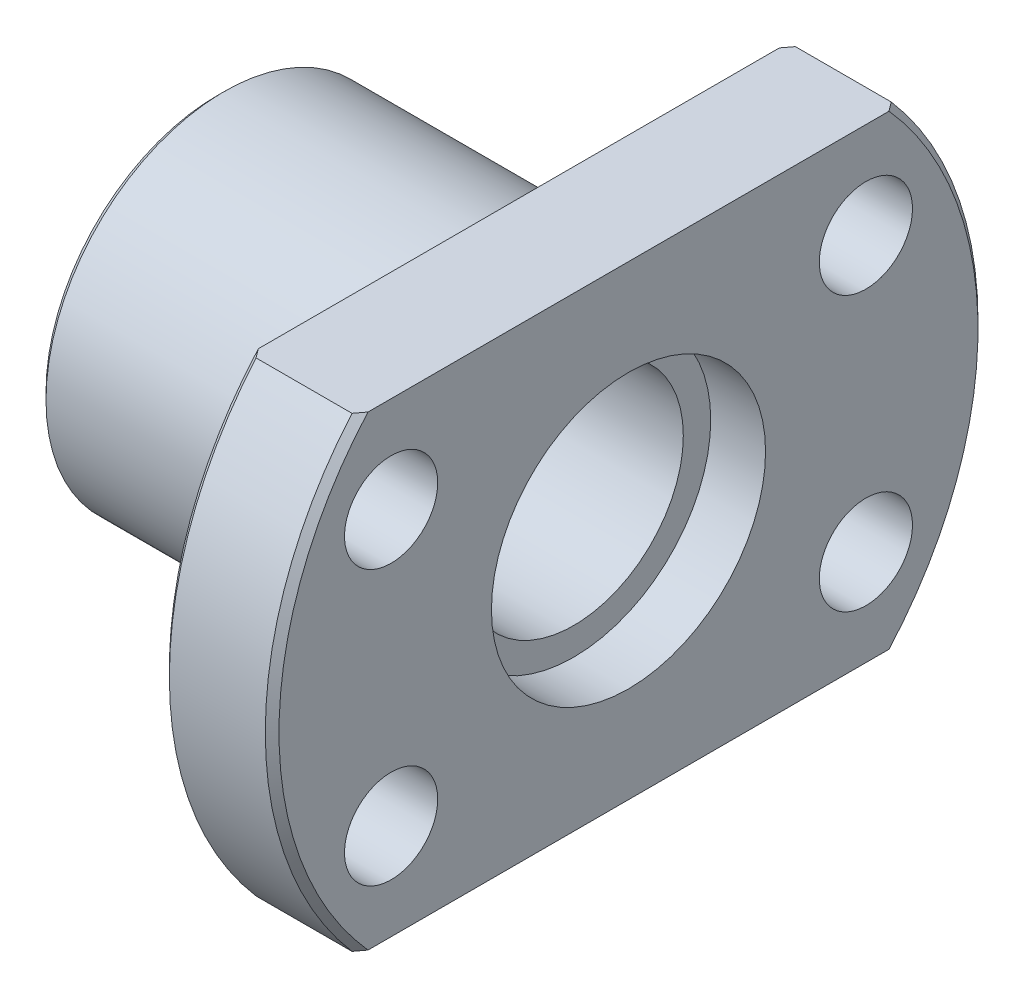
SolidWorks part; units mm, degrees
ref_plane "Front Plane" through (0, 0, 0) normal (0, 0, 1) x (1, 0, 0)
ref_plane "Top Plane" through (0, 0, 0) normal (0, 1, 0) x (1, 0, 0)
ref_plane "Right Plane" through (0, 0, 0) normal (1, 0, 0) x (0, 0, -1)
ref_plane "Plane1" through (0, 0, 0) normal (0, 0, 1) x (1, 0, 0)
sketch "Sketch1" plane through (0, 0, 0) normal (0, 0, 1) x (1, 0, 0)
  line L0 (0, 6.25) -> (0, 5)
  line L1 (0, 5) -> (2, 5)
  line L2 (2, 5) -> (2, 4)
  line L3 (2, 4) -> (13, 4)
  line L4 (13, 4) -> (13, 5)
  line L5 (13, 5) -> (15, 5)
  line L6 (15, 5) -> (15, 12.75)
  line L7 (15, 12.75) -> (14.75, 13)
  line L8 (14.75, 13) -> (11.25, 13)
  line L9 (11.25, 13) -> (11, 12.75)
  line L10 (11, 12.75) -> (11, 6)
  line L11 (11, 6) -> (10.5, 6)
  line L12 (10.5, 6) -> (10.5, 6.5)
  line L13 (10.5, 6.5) -> (0.25, 6.5)
  line L14 (0.25, 6.5) -> (0, 6.25)
  line L15 (15, 0) -> (0, 0) construction
revolve "Revolve1" add sketch "Sketch1" angle 360 about L15
ref_plane "Plane2" through (15, 0, 0) normal (1, 0, 0) x (0, 0, -1)
sketch "Sketch2" plane through (15, 0, 0) normal (1, 0, 0) x (0, 0, -1)
  line L0 (-26, 17) -> (-26, -17)
  line L1 (-26, -17) -> (26, -17)
  line L2 (26, -17) -> (26, 17)
  line L3 (26, 17) -> (-26, 17)
  line L4 (-13.1, 8.5) -> (-13.1, -8.5)
  line L5 (-13.1, -8.5) -> (13.1, -8.5)
  line L6 (13.1, -8.5) -> (13.1, 8.5)
  line L7 (13.1, 8.5) -> (-13.1, 8.5)
extrude "Cut-Extrude1" cut sketch "Sketch2" against normal blind 4
ref_plane "Plane3" through (0, 0, 0) normal (0, 0.866, 0.5) x (1, 0, 0)
sketch "Sketch3" plane through (0, 0, 0) normal (0, 0.866, 0.5) x (1, 0, 0)
  line L0 (11, 10) -> (11, 11.7)
  line L1 (11, 11.7) -> (15, 11.7)
  line L2 (15, 11.7) -> (15, 10)
  line L3 (15, 10) -> (11, 10)
  line L4 (15, 10) -> (11, 10) construction
revolve "Cut-Revolve1" cut sketch "Sketch3" angle 360 about L4
ref_plane "Plane4" through (0, -7.5, -4.3301) normal (0, 0.866, 0.5) x (1, 0, 0)
sketch "Sketch4" plane through (0, -7.5, -4.3301) normal (0, 0.866, 0.5) x (1, 0, 0)
  line L0 (11, 5) -> (11, 6.7)
  line L1 (11, 6.7) -> (15, 6.7)
  line L2 (15, 6.7) -> (15, 5)
  line L3 (15, 5) -> (11, 5)
  line L4 (15, 5) -> (11, 5) construction
revolve "Cut-Revolve2" cut sketch "Sketch4" angle 360 about L4
ref_plane "Plane5" through (0, 0, 0) normal (0, 0.866, 0.5) x (1, 0, 0)
sketch "Sketch5" plane through (0, 0, 0) normal (0, 0.866, 0.5) x (1, 0, 0)
  line L0 (11, -10) -> (11, -8.3)
  line L1 (11, -8.3) -> (15, -8.3)
  line L2 (15, -8.3) -> (15, -10)
  line L3 (15, -10) -> (11, -10)
  line L4 (15, -10) -> (11, -10) construction
revolve "Cut-Revolve3" cut sketch "Sketch5" angle 360 about L4
ref_plane "Plane6" through (0, 7.5, 4.3301) normal (0, 0.866, 0.5) x (1, 0, 0)
sketch "Sketch6" plane through (0, 7.5, 4.3301) normal (0, 0.866, 0.5) x (1, 0, 0)
  line L0 (11, -5) -> (11, -3.3)
  line L1 (11, -3.3) -> (15, -3.3)
  line L2 (15, -3.3) -> (15, -5)
  line L3 (15, -5) -> (11, -5)
  line L4 (15, -5) -> (11, -5) construction
revolve "Cut-Revolve4" cut sketch "Sketch6" angle 360 about L4
